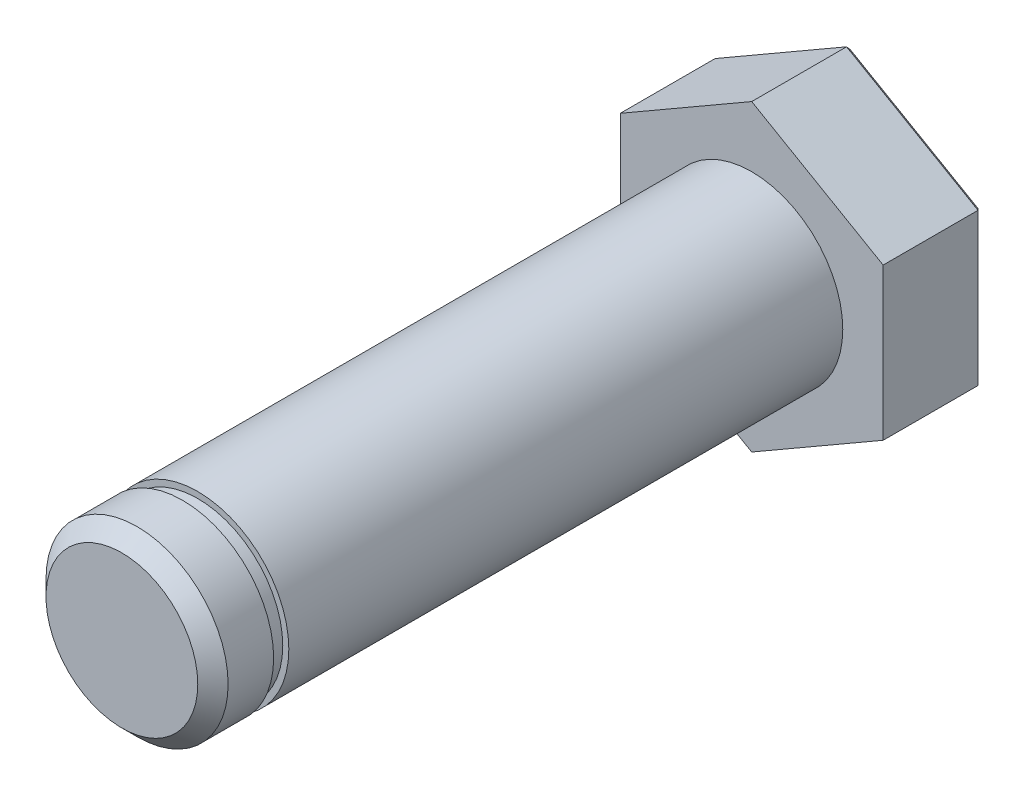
SolidWorks part; units mm, degrees
ref_plane "Plan1" through (0, 0, 0) normal (0, 0, 1) x (1, 0, 0)
ref_plane "Plan2" through (0, 0, 0) normal (0, 1, 0) x (1, 0, 0)
ref_plane "Plan3" through (0, 0, 0) normal (1, 0, 0) x (0, 0, -1)
sketch "Esquisse1" plane through (0, 0, 0) normal (0, 0, 1) x (1, 0, 0)
  circle A0 centre (0, 0) radius 6
  dimension "D1" = 12
extrude "Base-Extrusion" add sketch "Esquisse1" along normal blind 36.5
sketch "Esquisse2" plane through (0, 0, 0) normal (0, 0, -1) x (-1, 0, 0)
  line L1 (0, -10) -> (8.6603, -5)
  line L2 (8.6603, -5) -> (8.6603, 5)
  line L3 (8.6603, 5) -> (0, 10)
  line L4 (0, 10) -> (-8.6603, 5)
  line L5 (-8.6603, 5) -> (-8.6603, -5)
  line L6 (-8.6603, -5) -> (0, -10)
  circle A0 centre (0, 0) radius 8.6603 construction
extrude "Boss.-Extru.1" add sketch "Esquisse2" along normal blind 6.5
chamfer "Chanfrein1" distance 0.25 angle 45
chamfer "Chanfrein2" distance 0.25 angle 45
chamfer "Chanfrein3" distance 0.25 angle 45
chamfer "Chanfrein4" distance 0.25 angle 45
chamfer "Chanfrein5" distance 0.25 angle 45
chamfer "Chanfrein6" distance 0.25 angle 45
sketch "Esquisse3" plane through (0, 0, 36.5) normal (0, 0, 1) x (1, 0, 0)
  circle A0 centre (0, 0) radius 5.6
  circle A1 centre (0, 0) radius 6 construction
  dimension "D1" = 11.2
extrude "Boss.-Extru.3" add sketch "Esquisse3" along normal blind 1
sketch "Esquisse4" plane through (0, 0, 37.5) normal (0, 0, 1) x (1, 0, 0)
  circle A0 centre (0, 0) radius 6
  circle A1 centre (0, 0) radius 5.6 construction
  dimension "D1" = 12
extrude "Boss.-Extru.4" add sketch "Esquisse4" along normal blind 4
chamfer "Chanfrein7" distance 1 angle 45
